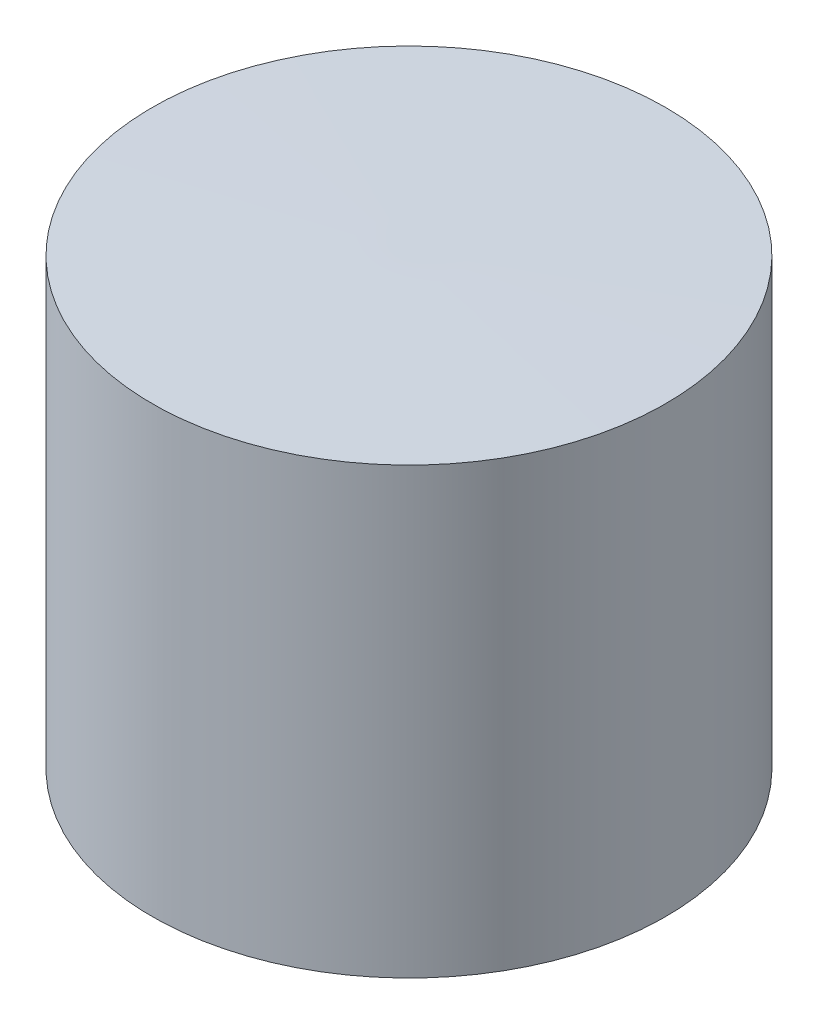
SolidWorks part; units mm, degrees
ref_plane "Front Plane" through (0, 0, 0) normal (0, 0, 1) x (1, 0, 0)
ref_plane "Top Plane" through (0, 0, 0) normal (0, 1, 0) x (1, 0, 0)
ref_plane "Right Plane" through (0, 0, 0) normal (1, 0, 0) x (0, 0, -1)
sketch "Sketch1" plane through (0, 0, 0) normal (0, 0, 1) x (1, 0, 0)
  line L0 (0, 0) -> (0, 90.8812)
  line L1 (0, 90.8812) -> (52.07, 90.1239)
  line L2 (52.07, 90.1239) -> (52.07, 0)
  line L3 (52.07, 0) -> (0, 0)
  dimension "D1" = 90.8812
  dimension "D2" = 52.07
revolve "Revolve1" add sketch "Sketch1" angle 360 about L0
